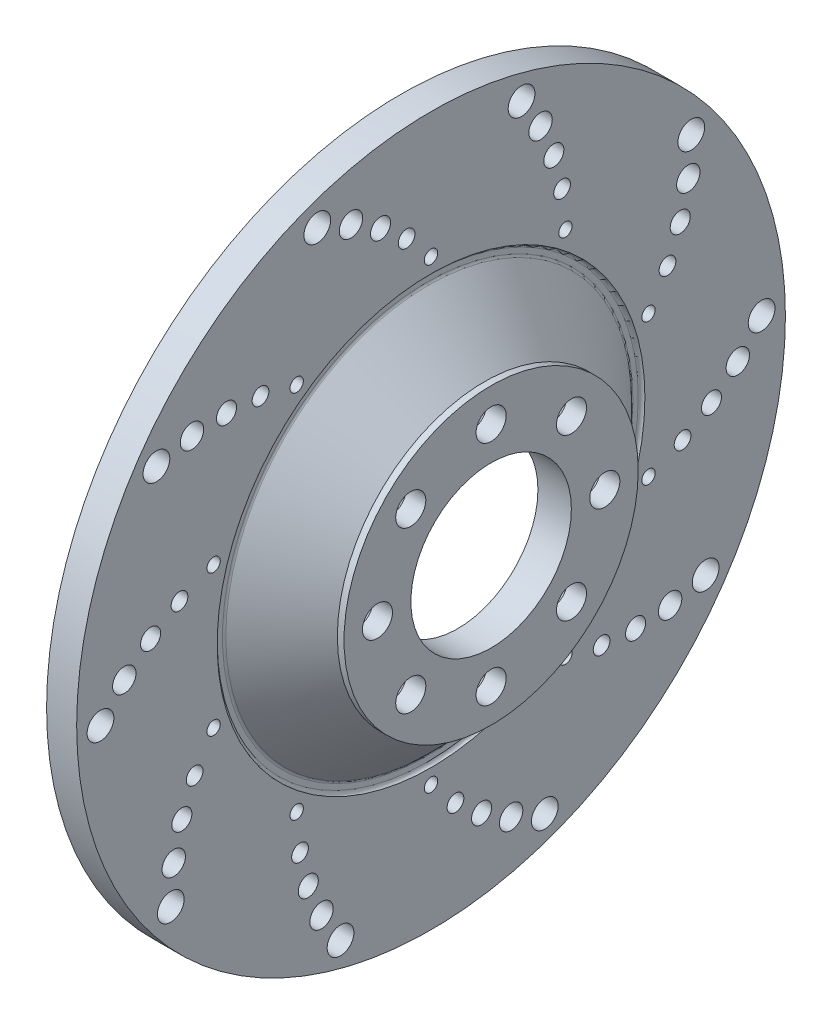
SolidWorks part; units mm, degrees
ref_plane "Face" through (0, 0, 0) normal (0, 0, 1) x (1, 0, 0)
ref_plane "Dessus" through (0, 0, 0) normal (0, 1, 0) x (1, 0, 0)
ref_plane "Droite" through (0, 0, 0) normal (1, 0, 0) x (0, 0, -1)
sketch "Esquisse1" plane through (0, 0, 0) normal (0, 0, 1) x (1, 0, 0)
  line L0 (0, 24) -> (0, 44)
  line L1 (0, 44) -> (-2, 44)
  line L2 (-2, 44) -> (-18.9706, 60.9706)
  line L3 (-18.9706, 60.9706) -> (-18.9706, 63.9706)
  line L4 (-18.9706, 63.9706) -> (-17.9706, 63.9706)
  line L5 (-17.9706, 63.9706) -> (-17.9706, 106)
  line L6 (-17.9706, 106) -> (-26.9706, 106)
  line L7 (-26.9706, 106) -> (-26.9706, 63.9706)
  line L8 (-26.9706, 63.9706) -> (-25.9706, 63.9706)
  line L9 (-25.9706, 63.9706) -> (-25.9706, 60.9706)
  line L10 (-25.9706, 60.9706) -> (-9, 44)
  line L11 (-9, 44) -> (-10, 44)
  line L12 (-10, 44) -> (-10, 24)
  line L13 (-10, 24) -> (0, 24)
  line L14 (0, 0) -> (-56.4065, 0) construction
  dimension "D1" = 24
  dimension "D2" = 10
  dimension "D3" = 20
  dimension "D4" = 2
  dimension "D5" = 45
  dimension "D6" = 1
  dimension "D7" = 24
  dimension "D8" = 3
  dimension "D9" = 1
  dimension "D10" = 106
  dimension "D11" = 9
revolve "Révolution1" add sketch "Esquisse1" angle 360 about L14
hole_wizard "Fraisage pour vis à tête fraisée M81" positions "Esquisse3" profile "Esquisse2" countersink size "M8" standard "ISO"
sketch "Esquisse3" plane through (-10, 0, 0) normal (-1, 0, 0) x (0, 0, 1)
  line L0 (0, 0) -> (0, 34) construction
  point P0 (0, 34)
  dimension "D1" = 34
sketch "Esquisse2" plane through (-10, 34, 0) normal (0, 1, 0) x (0, 0, 1)
  line L0 (0, 0) -> (0, 10)
  line L1 (0, 10) -> (4.5, 10)
  line L2 (4.5, 10) -> (4.5, 4.15)
  line L3 (4.5, 4.15) -> (8.65, 0)
  line L5 (8.65, 0) -> (0, 0)
  line L6 (-4.5, 4.15) -> (-8.65, 0) construction
  line L11 (0, -6.35) -> (0, 107.95) construction
  dimension "Diamètre du perçage jusqu'au prochain" = 9
  dimension "Profondeur du perçage jusqu'au prochain" = 10
  dimension "Diamètre du fraisage entrant" = 17.3
  dimension "Angle du fraisage entrant" = 90
pattern_circular "Répétition circulaire1" count 8 over 360 about axis through (0, 0, 0) along (1, 0, 0) of "Fraisage pour vis à tête fraisée M81"
sketch "Esquisse4" plane through (-26.9706, 0, 0) normal (-1, 0, 0) x (0, 0, 1)
  line L0 (0, 0) -> (0, 68.3866) construction
  arc A0 (0, 68.3866) -> (34.032, 92.9026) centre (55.5978, 27.087) cw construction
  circle A1 centre (0, 68.3866) radius 2
  circle A2 centre (15.1156, 83.2827) radius 3
  circle A3 centre (34.032, 92.9026) radius 4
  circle A4 centre (7.3052, 76.7317) radius 2.5
  circle A5 centre (23.9508, 88.6925) radius 3.5
  dimension "D1" = 4
  dimension "D2" = 6
  dimension "D3" = 8
  dimension "D4" = 5
  dimension "D5" = 7
extrude "Enlèv. mat.-Extru.1" cut sketch "Esquisse4" against normal through all
pattern_circular "Répétition circulaire2" count 10 over 360 about axis through (0, 0, 0) along (1, 0, 0) of "Enlèv. mat.-Extru.1"
fillet "Congé1" radius 1 4 edges at (-25.9706, 0, -60.9706) (-25.9706, 0, -63.9706) (-18.9706, 0, -63.9706) (-18.9706, 0, -60.9706)
